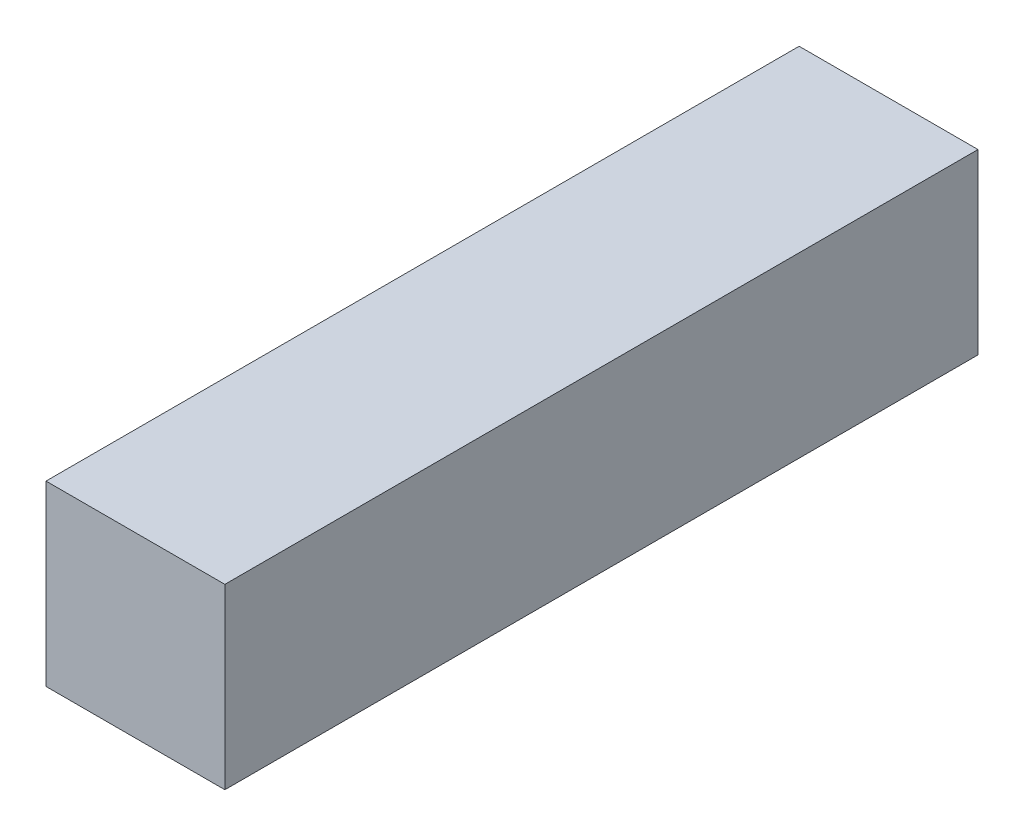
SolidWorks part; units mm, degrees
ref_plane "Front Plane" through (0, 0, 0) normal (0, 0, 1) x (1, 0, 0)
ref_plane "Top Plane" through (0, 0, 0) normal (0, 1, 0) x (1, 0, 0)
ref_plane "Right Plane" through (0, 0, 0) normal (1, 0, 0) x (0, 0, -1)
sketch "Sketch2" plane through (0, 0, 0) normal (0, 0, 1) x (1, 0, 0)
  line L1 (0, 0) -> (4.75, 0)
  line L2 (0, 0) -> (0, 4.724)
  line L3 (0, 4.724) -> (4.75, 4.724)
  line L4 (4.75, 0) -> (4.75, 4.724)
  dimension "D1" = 4.724
  dimension "D2" = 4.75
extrude "Boss-Extrude1" add sketch "Sketch2" along normal blind 20
